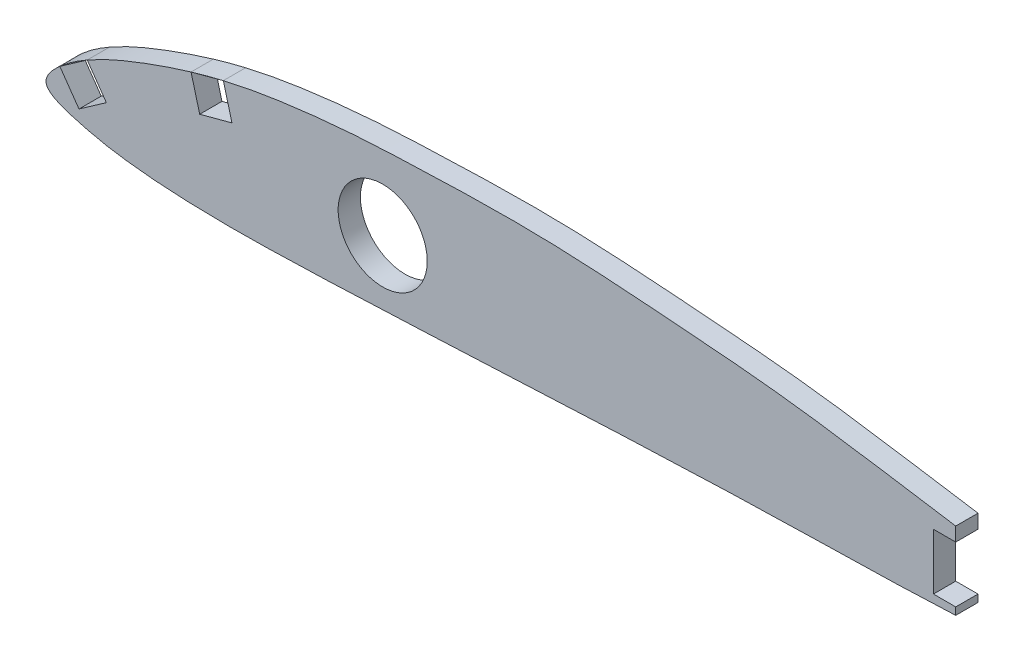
SolidWorks part; units mm, degrees
ref_plane "Front Plane" through (0, 0, 0) normal (0, 0, 1) x (1, 0, 0)
ref_plane "Top Plane" through (0, 0, 0) normal (0, 1, 0) x (1, 0, 0)
ref_plane "Right Plane" through (0, 0, 0) normal (1, 0, 0) x (0, 0, -1)
sketch3d "3DSketch1"
  spline S1 degree 3 poles (4.5593, -2.7075, 0) (-1.6846, -0.7404, 0) (2.0075, 3.0552, 0) (4.9277, 5.1467, 0) (8.7125, 7.1848, 0) (15.9605, 10.133, 0) (24.7528, 12.9383, 0) (35.1604, 14.6026, 0) (43.9814, 15.4829, 0) (55.723, 15.975, 0) (70.4148, 16.3917, 0) (87.9988, 15.1576, 0) (105.7097, 13.7776, 0) (123.0188, 11.0048, 0) (141.5868, 8.1662, 0) (155.7572, 4.8325, 0) (185.9214, -1.1424, 0) (146.892, 0.2323, 0) (129.919, -1.321, 0) (93.279, -1.8986, 0) (64.6376, -3.4593, 0) (35.1488, -4.7447, 0) (20.6566, -4.9823, 0) (9.9896, -3.9492, 0) (4.5593, -2.7075, 0) (-1.6846, -0.7404, 0) (2.0075, 3.0552, 0) knots -0.051806 -0.027094 -0.014492 0 0.01056 0.018211 0.03221 0.045525 0.084069 0.108974 0.133649 0.158233 0.207343 0.256523 0.305826 0.355445 0.405214 0.45539 0.506007 0.555122 0.65337 0.70249 0.849939 0.899083 0.948194 0.972906 0.985508 1 1.01056 1.018211 1.03221 only from (0, 0, 0) to (0, 0, 0)
  dimension "D1" = 175.99
extrude "Boss-Extrude1" add sketch "3DSketch1" along direction (0, 0, 1) on the side of the normal blind 3.175
sketch "Sketch1" plane through (0, 0, 3.175) normal (0, 0, 1) x (1, 0, 0)
  line L0 (0, 0) -> (175.99, 0) construction
  line L1 (87.995, 0) -> (87.995, 5) construction
  line L2 (87.995, 5) -> (47.995, 5) construction
  line L3 (129.677, 0) -> (129.677, -7.2265)
  line L4 (129.677, 23.6321) -> (195.0498, 23.6321)
  line L5 (129.677, 23.6321) -> (129.677, 8)
  line L6 (129.677, -7.2265) -> (195.0498, -7.2265)
  line L7 (195.0498, 23.6321) -> (195.0498, -7.2265)
  line L8 (126.502, 8) -> (129.677, 8)
  line L9 (126.502, 8) -> (126.502, 0)
  line L10 (126.502, 0) -> (129.677, 0)
  line L11 (1.9715, 2.8793) -> (5.8727, 5.6109)
  line L12 (1.9715, 2.8793) -> (4.7032, -1.0219)
  line L13 (5.8727, 5.6109) -> (8.6044, 1.7097)
  line L14 (4.7032, -1.0219) -> (8.6044, 1.7097)
  line L15 (20.6768, 11.5337) -> (25.2771, 12.7663)
  line L16 (20.6768, 11.5337) -> (21.9095, 6.9334)
  line L17 (25.2771, 12.7663) -> (26.5097, 8.1661)
  line L18 (21.9095, 6.9334) -> (26.5097, 8.1661)
  circle A0 centre (47.995, 5) radius 6.35
  spline S0 degree 3 poles (2.0075, 3.0552) (-1.6846, -0.7404) (4.5593, -2.7075) (9.9896, -3.9492) (20.6566, -4.9823) (35.1488, -4.7447) (64.6376, -3.4593) (93.279, -1.8986) (129.919, -1.321) (146.892, 0.2323) (185.9214, -1.1424) (155.7572, 4.8325) (141.5868, 8.1662) (123.0188, 11.0048) (105.7097, 13.7776) (87.9988, 15.1576) (70.4148, 16.3917) (55.723, 15.975) (43.9814, 15.4829) (35.1604, 14.6026) (24.7528, 12.9383) (15.9605, 10.133) (8.7125, 7.1848) (4.9277, 5.1467) (2.0075, 3.0552) (-1.6846, -0.7404) (4.5593, -2.7075) knots -0.03221 -0.018211 -0.01056 0 0.014492 0.027094 0.051806 0.100917 0.150061 0.29751 0.34663 0.444878 0.493993 0.54461 0.594786 0.644555 0.694174 0.743477 0.792657 0.841767 0.866351 0.891026 0.915931 0.954475 0.96779 0.981789 0.98944 1 1.014492 1.027094 1.051806 only from (0, 0) to (0, 0) construction
  dimension "D3" = 41.682
  dimension "D1" = 5
  dimension "D2" = 40
  dimension "D4" = 8
  dimension "D5" = 3.175
  dimension "D6" = 4.7625
  dimension "D7" = 4.7625
  dimension "D8" = 55
  dimension "D9" = 4.7625
  dimension "D10" = 4.7625
  dimension "D11" = 75
extrude "Cut-Extrude1" cut sketch "Sketch1" against normal blind 10
